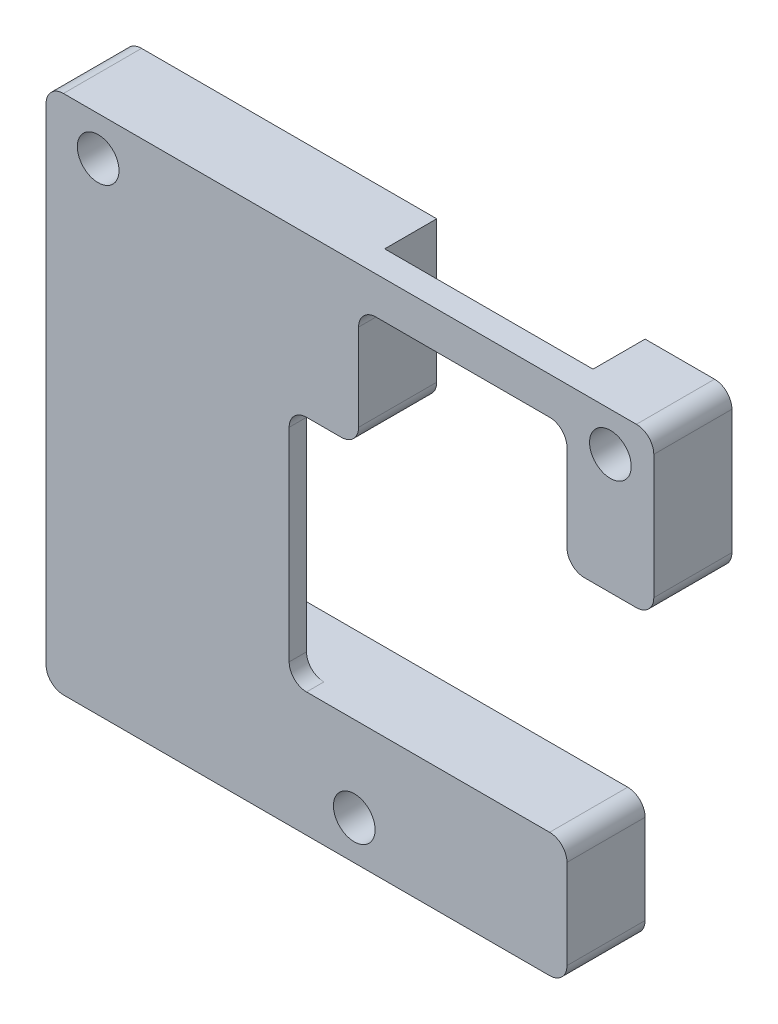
SolidWorks part; units mm, degrees
ref_plane "Front Plane" through (0, 0, 0) normal (0, 0, 1) x (1, 0, 0)
ref_plane "Top Plane" through (0, 0, 0) normal (0, 1, 0) x (1, 0, 0)
ref_plane "Right Plane" through (0, 0, 0) normal (1, 0, 0) x (0, 0, -1)
sketch "Sketch2" plane through (0, 0, 0) normal (0, 0, 1) x (1, 0, 0)
  line L0 (49.9, 10.85) -> (6.9, 10.85) construction
  line L1 (4.4, 15) -> (22.4, 15)
  line L2 (4.4, 15) -> (4.4, 5.85)
  line L3 (4.4, 5.85) -> (22.4, 5.85)
  line L4 (22.4, 12.85) -> (22.4, 5.85)
  line L6 (6.4, 10.35) -> (6.4, -10.35) construction
  line L7 (-50, -15) -> (50, -15) construction
  line L8 (4.4, -15) -> (34.4, -15)
  line L9 (4.4, -15) -> (4.4, -7.85)
  line L10 (4.4, -7.85) -> (34.4, -7.85)
  line L11 (34.4, -15) -> (34.4, -7.85)
  line L12 (6.8, -7.85) -> (44, -7.85) construction
  line L13 (50.4, -10.35) -> (50.4, 10.35) construction
  line L14 (34.4, 15) -> (39.4, 15)
  line L15 (34.4, 12.85) -> (34.4, 5.85)
  line L16 (34.4, 5.85) -> (39.4, 5.85)
  line L17 (39.4, 15) -> (39.4, 5.85)
  line L19 (22.4, 15) -> (34.4, 15)
  line L21 (22.4, 12.85) -> (34.4, 12.85)
  dimension "D1" = 5
  dimension "D2" = 2
  dimension "D3" = 16
  dimension "D4" = 28
  dimension "D5" = 11
  dimension "D6" = 5
  dimension "D7" = 7
  dimension "D8" = 9.15
extrude "Boss-Extrude1" add sketch "Sketch2" along normal blind 3.5
sketch "Sketch3" plane through (0, 0, 3.5) normal (0, 0, 1) x (1, 0, 0)
  line L0 (4.4, -15) -> (34.4, -15) construction
  line L1 (4.4, 15) -> (18.4, 15)
  line L2 (4.4, 15) -> (4.4, -15)
  line L3 (4.4, -15) -> (18.4, -15)
  line L4 (18.4, 15) -> (18.4, -15)
  line L5 (6.4, 10.35) -> (6.4, -10.35) construction
  dimension "D1" = 12
extrude "Boss-Extrude2" add sketch "Sketch3" along normal blind 1
sketch "Sketch5" plane through (0, 0, 3.5) normal (0, 0, 1) x (1, 0, 0)
  line L3 (18.4, -7.85) -> (18.4, -15) construction
  line L6 (18.4, 15) -> (18.4, 5.85) construction
  line L9 (22.4, 12.85) -> (34.4, 12.85) construction
  line L15 (18.4, -7.85) -> (18.4, -15)
  line L18 (18.4, 15) -> (18.4, 5.85)
  line L21 (22.4, 12.85) -> (34.4, 12.85)
  line L24 (22.4, 5.85) -> (22.4, 12.85) construction
  line L25 (34.4, 12.85) -> (34.4, 5.85) construction
  line L26 (34.4, 5.85) -> (39.4, 5.85) construction
  line L27 (39.4, 5.85) -> (39.4, 15) construction
  line L28 (39.4, 15) -> (18.4, 15) construction
  line L29 (22.4, 5.85) -> (22.4, 12.85)
  line L30 (34.4, 12.85) -> (34.4, 5.85)
  line L31 (34.4, 5.85) -> (39.4, 5.85)
  line L32 (39.4, 5.85) -> (39.4, 15)
  line L33 (39.4, 15) -> (18.4, 15)
  line L34 (18.4, 5.85) -> (22.4, 5.85) construction
  line L35 (18.4, 5.85) -> (22.4, 5.85)
  line L36 (18.4, -15) -> (34.4, -15) construction
  line L37 (34.4, -15) -> (34.4, -7.85) construction
  line L38 (34.4, -7.85) -> (18.4, -7.85) construction
  line L39 (18.4, -15) -> (34.4, -15)
  line L40 (34.4, -15) -> (34.4, -7.85)
  line L41 (34.4, -7.85) -> (18.4, -7.85)
extrude "Boss-Extrude3" add sketch "Sketch5" along normal up to surface (1 mm away)
sketch "Sketch7" plane through (0, 0, 4.5) normal (0, 0, 1) x (1, 0, 0)
  line L0 (7.4, 15) -> (7.4, 10.5) construction
  line L1 (39.4, 15) -> (4.4, 15) construction
  line L2 (4.4, 15) -> (4.4, -15) construction
  line L3 (7.4, 12.75) -> (36.9, 12.75) construction
  line L4 (4.4, -15) -> (34.4, -15) construction
  line L5 (19.4, -15) -> (19.4, 15) construction
  line L7 (22.15, 12.75) -> (22.15, -12.75) construction
  line L8 (39.4, 5.85) -> (39.4, 15) construction
  circle A0 centre (7.4, 12.75) radius 1.5 construction
  circle A1 centre (7.4, 12.75) radius 1.2
  circle A2 centre (36.9, 12.75) radius 1.2
  circle A3 centre (22.15, -12.75) radius 1.2
  dimension "D1" = 3
  dimension "D2" = 2.4
  dimension "D3" = 3
  dimension "D4" = 30
  dimension "D5" = 2.25
  dimension "D6" = 2.5
  dimension "D7" = 2.25
extrude "Cut-Extrude1" cut sketch "Sketch7" against normal through all
sketch "Sketch11" plane through (0, 12.85, 0) normal (0, -1, 0) x (1, 0, 0)
  line L0 (34.4, 4.5) -> (34.4, 0) construction
  line L1 (22.4, 0) -> (34.4, 0)
  line L2 (22.4, 0) -> (22.4, 3)
  line L3 (22.4, 3) -> (34.4, 3)
  line L4 (34.4, 0) -> (34.4, 3)
  line L5 (22.4, 4.5) -> (34.4, 4.5) construction
  dimension "D1" = 3
  dimension "D2" = 1.5
extrude "Cut-Extrude4" cut sketch "Sketch11" against normal through all
fillet "Fillet2" radius 1 12 edges at (34.4, 12.85, 3.75) (22.4, 12.85, 3.75) (18.4, -7.85, 4) (18.4, 5.85, 4) (22.4, 5.85, 2.25) (4.4, 15, 2.25) (4.4, -15, 2.25) (34.4, -7.85, 2.25) (34.4, -15, 2.25) (34.4, 5.85, 2.25) (39.4, 5.85, 2.25) (39.4, 15, 2.25)
